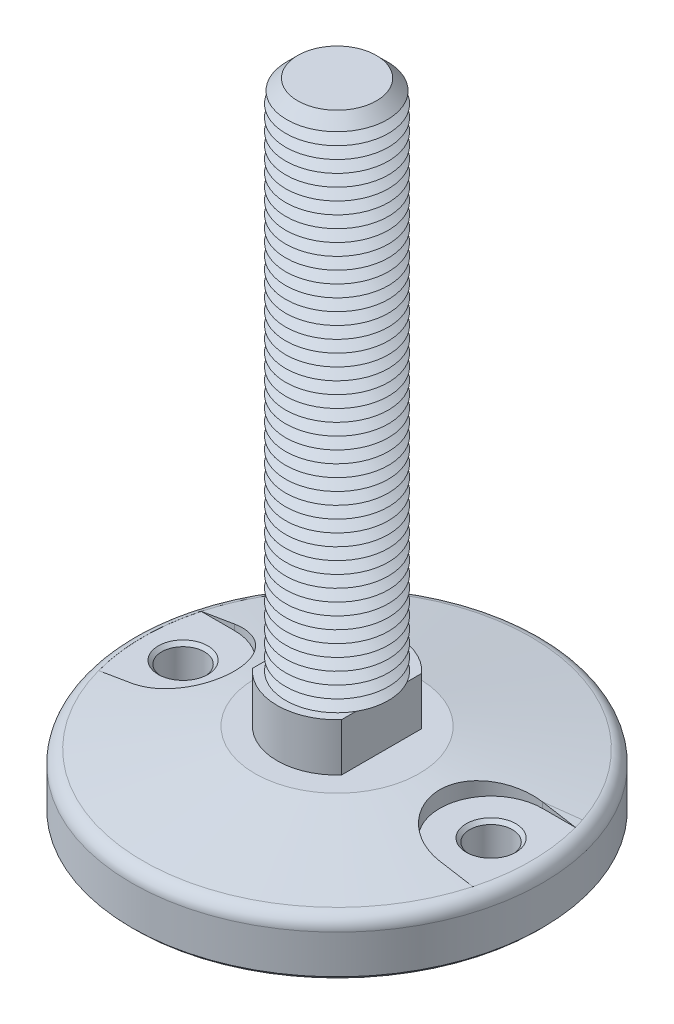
SolidWorks part; units mm, degrees
ref_plane "Front Plane" through (0, 0, 0) normal (0, 0, 1) x (1, 0, 0)
ref_plane "Top Plane" through (0, 0, 0) normal (0, 1, 0) x (1, 0, 0)
ref_plane "Right Plane" through (0, 0, 0) normal (1, 0, 0) x (0, 0, -1)
sketch "Sketch1" plane through (0, 0, 0) normal (1, 0, 0) x (0, 0, -1)
  line L0 (0, 61.3389) -> (0, -58.404) construction
sketch "Sketch2" plane through (0, 0, 0) normal (1, 0, 0) x (0, 0, -1)
  line L0 (0, 0) -> (-24, 0)
  line L1 (-24, 0) -> (-60, -6.3478)
  line L2 (-60, -6.3478) -> (-60, -22)
  line L3 (-60, -22) -> (0, -22)
  line L4 (0, 61.3389) -> (0, -58.404) construction
  line L5 (0, -22) -> (0, 0)
  dimension "D1" = 22
  dimension "D2" = 60
  dimension "D3" = 24
  dimension "D4" = 10
revolve "Revolve1" add sketch "Sketch2" angle 360 about L0
fillet "Fillet1" radius 4 1 edges at (0, -6.3478, 60)
sketch "Sketch3" plane through (0, 0, 0) normal (0, 1, 0) x (1, 0, 0)
  circle A0 centre (0, 0) radius 17.5
  dimension "D1" = 35
extrude "Boss-Extrude1" add sketch "Sketch3" along normal blind 14
sketch "Sketch4" plane through (0, 14, 0) normal (0, 1, 0) x (1, 0, 0)
  line L0 (-13, 11.7154) -> (-13, -11.7154)
  line L2 (13, -11.7154) -> (13, 11.7154)
  arc A0 (-13, 11.7154) -> (-13, -11.7154) centre (0, 0) ccw
  circle A1 centre (0, 0) radius 17.5 construction
  arc A2 (13, -11.7154) -> (13, 11.7154) centre (0, 0) ccw
  dimension "D1" = 26
extrude "Cut-Extrude1" cut sketch "Sketch4" against normal blind 14
sketch "Sketch5" plane through (0, 14, 0) normal (0, 1, 0) x (1, 0, 0)
  circle A0 centre (0, 0) radius 15
  dimension "D1" = 30
extrude "Boss-Extrude2" add sketch "Sketch5" along normal blind 150
chamfer "Chamfer1" distance 3.5 angle 45 1 edges at (0, 164, 15)
sketch "Sketch6" plane through (0, 0, 0) normal (1, 0, 0) x (0, 0, -1)
  line L0 (-15, 14) -> (-11.9689, 15.75)
  line L1 (-11.9689, 15.75) -> (-15, 17.5)
  line L2 (-15, 160.5) -> (-15, 14) construction
  line L3 (-15, 17.5) -> (-15, 14)
  dimension "D1" = 3.5
revolve "Cut-Revolve1" cut sketch "Sketch6" angle 360 about L0
pattern_linear "LPattern1" count 42 spacing 3.5 along (0, 1, 0) of "Cut-Revolve1"
sketch "Sketch8" plane through (0, 0, 0) normal (0, 1, 0) x (1, 0, 0)
  line L0 (-45, 15) -> (-54.6743, 15)
  line L1 (-45, -15) -> (-54.6743, -15)
  arc A1 (-54.6743, 15) -> (-54.6743, -15) centre (0, 0) ccw
  circle A2 centre (0, 0) radius 56.6946 construction
  arc A3 (-45, -15) -> (-45, 15) centre (-45, 0) ccw
  point P3 (-45, 0)
  point P11 (0, 0)
  dimension "D1" = 45
  dimension "D2" = 30
extrude "Cut-Extrude4" cut sketch "Sketch8" against normal blind 5.79
sketch "Sketch10" plane through (0, -5.79, 0) normal (0, 1, 0) x (1, 0, 0)
  circle A0 centre (-45, 0) radius 6.25
  dimension "D1" = 12.5
extrude "Cut-Extrude5" cut sketch "Sketch10" against normal up to surface (16.21 mm away)
chamfer "Chamfer2" distance 1 angle 45 2 edges at (-45, -22, -6.25) (-45, -5.79, 6.25)
mirror "Mirror1" about plane through (0, 0, 0) normal (1, 0, 0) of "Chamfer2", "Cut-Extrude5", "Cut-Extrude4"
chamfer "Chamfer3" distance 1 angle 45 1 edges at (0, -22, 60)
